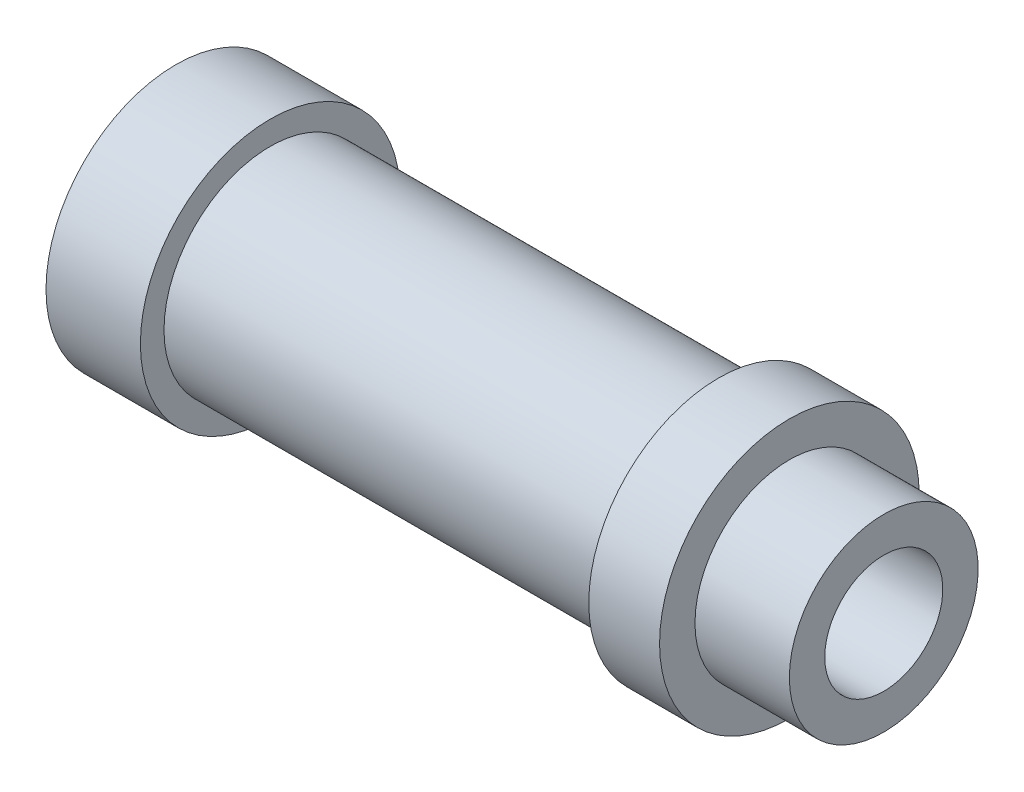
SolidWorks part; units mm, degrees
ref_plane "Front Plane" through (0, 0, 0) normal (0, 0, 1) x (1, 0, 0)
ref_plane "Top Plane" through (0, 0, 0) normal (0, 1, 0) x (1, 0, 0)
ref_plane "Right Plane" through (0, 0, 0) normal (1, 0, 0) x (0, 0, -1)
sketch "Sketch1" plane through (0, 0, 0) normal (0, 0, 1) x (1, 0, 0)
  line L0 (0, 2.75) -> (0, 2)
  line L1 (0, 2) -> (2.3083, 1.25)
  line L2 (2.3083, 1.25) -> (15, 1.25)
  line L3 (11.5, 2.75) -> (13, 2.75)
  line L4 (13, 2.75) -> (13, 2)
  line L5 (13, 2) -> (15, 2)
  line L6 (15, 2) -> (15, 1.25)
  line L9 (11.5, 2.75) -> (11.5, 2.25)
  line L10 (11.5, 2.25) -> (2, 2.25)
  line L11 (2, 2.25) -> (2, 2.75)
  line L12 (2, 2.75) -> (0, 2.75)
  line L13 (-6.06, 0) -> (15, 0) construction
  dimension "D1" = 2.75
  dimension "D2" = 2
  dimension "D3" = 1.25
  dimension "D4" = 2.25
  dimension "D5" = 18
  dimension "D6" = 2
  dimension "D7" = 11.5
  dimension "D8" = 13
  dimension "D9" = 15
  dimension "D10" = 2
  dimension "D12" = 2.3083
revolve "Revolve1" add sketch "Sketch1" angle 360 about L13
